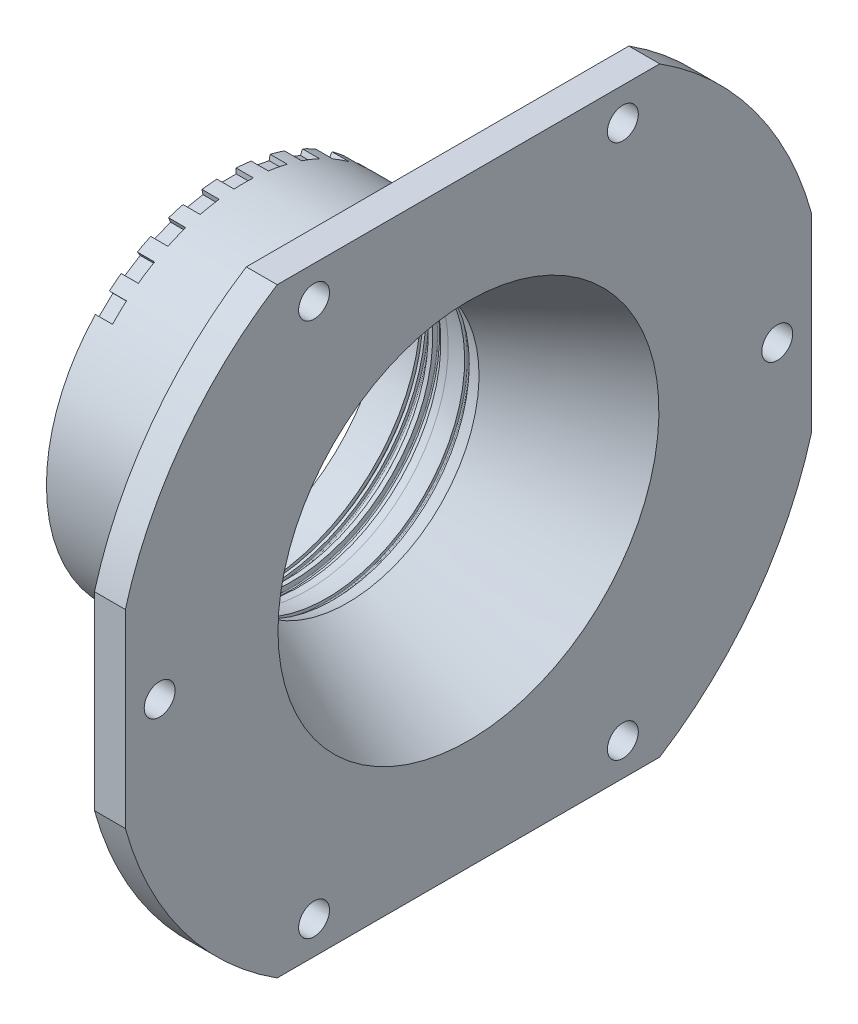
SolidWorks part; units mm, degrees
ref_plane "Plan de face" through (0, 0, 0) normal (0, 0, 1) x (1, 0, 0)
ref_plane "Plan de dessus" through (0, 0, 0) normal (0, 1, 0) x (1, 0, 0)
ref_plane "Plan de droite" through (0, 0, 0) normal (1, 0, 0) x (0, 0, -1)
sketch "Esquisse1" plane through (0, 0, 0) normal (0, 0, 1) x (1, 0, 0)
  line L18 (20.4, 95) -> (23.4, 95)
  line L20 (0, 92.75) -> (20.4, 92.75)
  line L26 (29, 91) -> (35, 91)
  line L28 (25.7, 93.3) -> (28.4, 93.3)
  line L32 (23.4, 91) -> (25.1, 91)
  line L35 (42.4, 82.55) -> (47, 82.55)
  line L37 (38.2, 86) -> (41.8, 86)
  line L41 (35, 82.55) -> (37.6, 82.55)
  line L44 (58.96, 82.6) -> (61.36, 82.6)
  line L48 (141, 111.0225) -> (70.52, 76.6471)
  line L50 (123, 120.6074) -> (123, 207.5)
  line L52 (91, 105) -> (123, 120.6074)
  line L54 (0, 105) -> (91, 105)
  line L57 (123, 207.5) -> (141, 207.5)
  line L59 (141, 111.0225) -> (141, 207.5)
  line L60 (-14.759, 0) -> (152.2736, 0) construction
  line L123 (20.4, 92.75) -> (20.4, 95)
  line L124 (23.4, 91) -> (23.4, 95)
  line L125 (25.1, 91) -> (25.1, 92.7)
  line L126 (29, 91) -> (29, 92.7)
  line L127 (35, 82.55) -> (35, 91)
  line L128 (37.6, 82.55) -> (37.6, 85.4)
  line L129 (42.4, 82.55) -> (42.4, 85.4)
  line L130 (47, 82.2025) -> (47, 82.55)
  line L131 (58.36, 80.4311) -> (58.36, 82)
  line L132 (61.96, 79.5236) -> (61.96, 82)
  line L133 (0, 92.75) -> (0, 105)
  arc A18 (58.36, 80.4311) -> (47, 82.2025) centre (40, 0) ccw
  arc A19 (70.52, 76.6471) -> (61.96, 79.5236) centre (40, 0) ccw
  arc A25 (38.2, 86) -> (37.6, 85.4) centre (38.2, 85.4) ccw
  arc A26 (42.4, 85.4) -> (41.8, 86) centre (41.8, 85.4) ccw
  arc A29 (58.96, 82.6) -> (58.36, 82) centre (58.96, 82) ccw
  arc A30 (61.96, 82) -> (61.36, 82.6) centre (61.36, 82) ccw
  arc A35 (25.7, 93.3) -> (25.1, 92.7) centre (25.7, 92.7) ccw
  arc A36 (29, 92.7) -> (28.4, 93.3) centre (28.4, 92.7) ccw
  point P113 (40, 0)
  point P128 (40, 0)
  point P223 (60.1556, 80)
  point P224 (40, 82.5)
  dimension "D1" = 415
revolve "Révolution1" add sketch "Esquisse1" angle 360 about L60
sketch "Esquisse3" plane through (123, 0, 0) normal (-1, 0, 0) x (0, 0, 1)
  line L0 (-242.0016, 0) -> (249.5473, 0) construction
  line L1 (-200, 175) -> (200, 175)
  line L2 (-200, 175) -> (-200, -175)
  line L3 (-200, -175) -> (200, -175)
  line L4 (200, 175) -> (200, -175)
  line L5 (0, 219.3645) -> (0, -243.0795) construction
  dimension "D1" = 350
  dimension "D2" = 400
extrude "Extrusion1" cut sketch "Esquisse3" against normal blind 84 flip side to cut
sketch "Esquisse4" plane through (123, 0, 0) normal (-1, 0, 0) x (0, 0, 1)
  line L0 (0, 193.1883) -> (0, 0) construction
  line L1 (0, 0) -> (-106.1309, 183.8241) construction
  circle A0 centre (0, 0) radius 180 construction
  circle A1 centre (-90, 155.8846) radius 9
  circle A2 centre (90, 155.8846) radius 9
  circle A3 centre (180, 0) radius 9
  circle A4 centre (90, -155.8846) radius 9
  circle A5 centre (-90, -155.8846) radius 9
  circle A6 centre (-180, 0) radius 9
  point P4 (-90, 155.8846)
  dimension "D1" = 360
  dimension "D3" = 18
  dimension "D2" = 30
extrude "Extrusion2" cut sketch "Esquisse4" against normal blind 84
sketch "Esquisse5" plane through (0, 0, 0) normal (-1, 0, 0) x (0, 0, 1)
  line L0 (0, 168.3103) -> (0, 0) construction
  line L1 (0, 0) -> (-111.091, 116.3964) construction
  line L2 (-66.2492, 77.5626) -> (-74.3898, 69.793)
  line L3 (-74.3898, 69.793) -> (-132.976, 131.1771)
  line L4 (-132.976, 131.1771) -> (-124.8353, 138.9467)
  line L5 (-124.8353, 138.9467) -> (-66.2492, 77.5626)
  dimension "D1" = 43.664
extrude "Extrusion3" cut sketch "Esquisse5" against normal blind 10
pattern_circular "Répétition circulaire1" count 9 every 10.916 about axis through (0, 0, 0) along (1, 0, 0) of "Extrusion3"
sketch "Esquisse6" plane through (0, 0, 0) normal (0, 0, 1) x (1, 0, 0)
  line L0 (-14.759, 0) -> (152.2736, 0) construction
  line L1 (-14.759, 0) -> (152.2736, 0) construction
  line L2 (40, 66.4836) -> (40, -67.8497) construction
  point P5 (40, 0)
